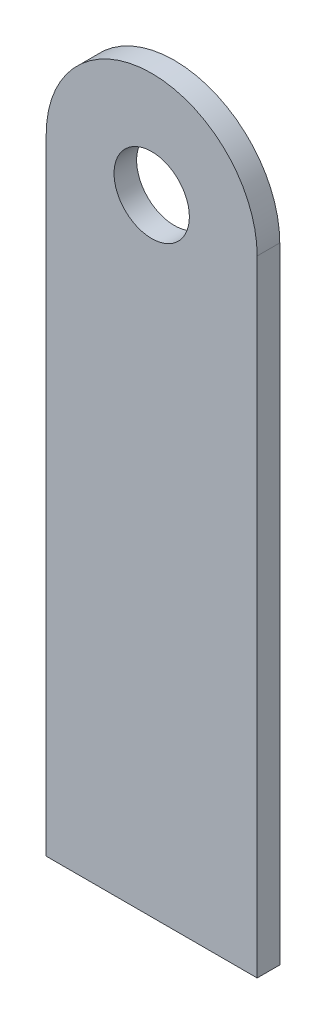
SolidWorks part; units mm, degrees
ref_plane "Plan de face" through (0, 0, 0) normal (0, 0, 1) x (1, 0, 0)
ref_plane "Plan de dessus" through (0, 0, 0) normal (0, 1, 0) x (1, 0, 0)
ref_plane "Plan de droite" through (0, 0, 0) normal (1, 0, 0) x (0, 0, -1)
sketch "Esquisse1" plane through (0, 0, 0) normal (0, 0, 1) x (1, 0, 0)
  line L0 (0, 0) -> (2.8, 0)
  line L1 (2.8, 0) -> (2.8, 8.3)
  line L2 (0, 8.3) -> (0, 0)
  arc A0 (2.8, 8.3) -> (0, 8.3) centre (1.4, 8.3) ccw
  circle A1 centre (1.4, 8.3) radius 0.5
  dimension "D1" = 1.4
  dimension "D3" = 1
  dimension "D2" = 8.3
extrude "Extrusion1" add sketch "Esquisse1" along normal blind 0.3
